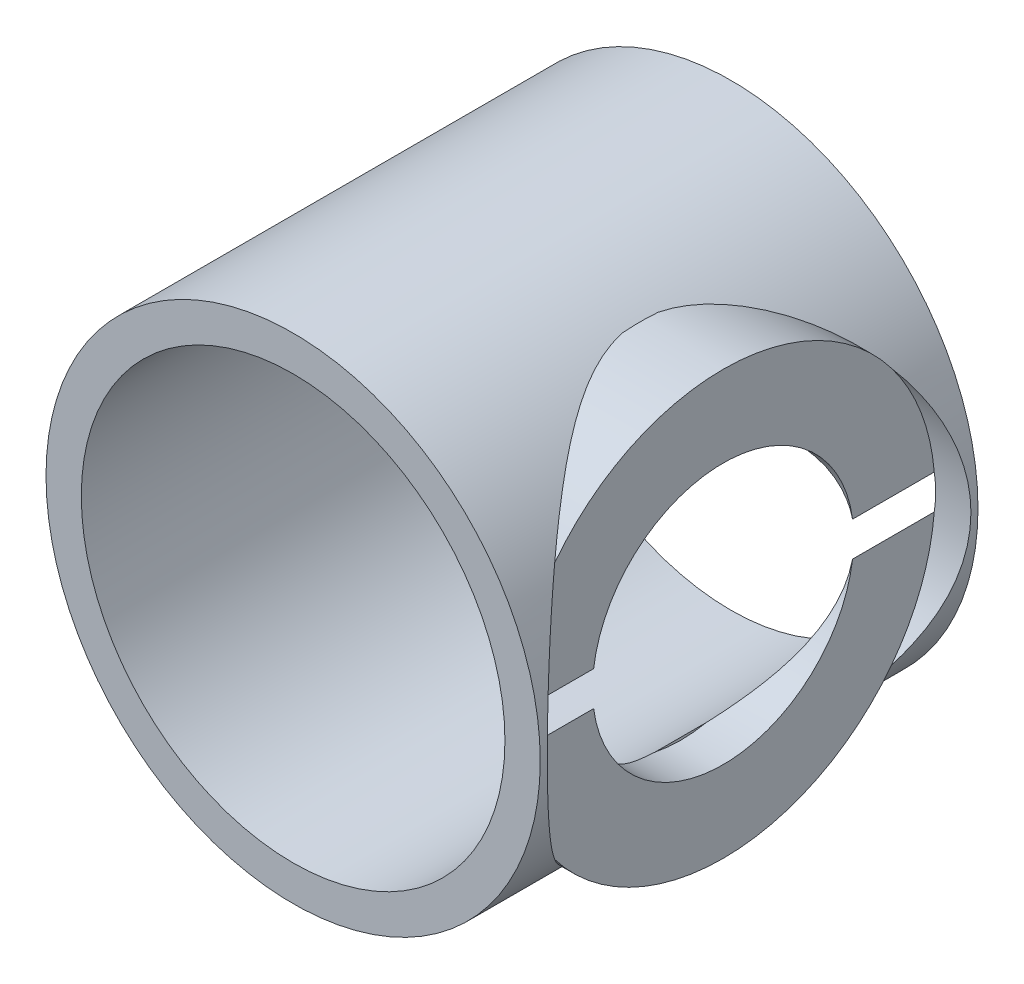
SolidWorks part; units mm, degrees
ref_plane "Front Plane" through (0, 0, 0) normal (0, 0, 1) x (1, 0, 0)
ref_plane "Top Plane" through (0, 0, 0) normal (0, 1, 0) x (1, 0, 0)
ref_plane "Right Plane" through (0, 0, 0) normal (1, 0, 0) x (0, 0, -1)
sketch "Sketch1" plane through (0, 0, 0) normal (0, 0, 1) x (1, 0, 0)
  circle A0 centre (0, 0) radius 44.45
  circle A1 centre (0, 0) radius 38.1
  dimension "D1" = 88.9
  dimension "D2" = 76.2
extrude "Boss-Extrude1" add sketch "Sketch1" along normal blind 78.74
ref_plane "Plane1" through (44.45, 0, 0) normal (1, 0, 0) x (0, 0, -1)
sketch "Sketch2" plane through (44.45, 0, 0) normal (1, 0, 0) x (0, 0, -1)
  line L0 (-78.74, 44.45) -> (-78.74, -44.45) construction
  circle A0 centre (-39.37, 0) radius 38.1
  dimension "D1" = 76.2
  dimension "D2" = 39.37
extrude "Boss-Extrude2" add sketch "Sketch2" against normal blind 21.336
sketch "Sketch3" plane through (0, 0, 78.74) normal (0, 0, 1) x (1, 0, 0)
  circle A0 centre (0, 0) radius 38.1
extrude "Cut-Extrude1" cut sketch "Sketch3" against normal blind 134.366
sketch "Sketch8" plane through (44.45, 0, 0) normal (1, 0, 0) x (0, 0, -1)
  circle A0 centre (-39.37, 0) radius 38.1
sketch "Sketch9" plane through (44.45, 0, 0) normal (1, 0, 0) x (0, 0, -1)
  circle A0 centre (-39.37, 0) radius 38.1
  dimension "D1" = 76.2
extrude "Cut-Extrude9" cut sketch "Sketch9" against normal blind 6.477
sketch "Sketch10" plane through (37.973, 0, 0) normal (1, 0, 0) x (0, 0, -1)
  circle A0 centre (-39.37, 0) radius 23.495
  dimension "D1" = 46.99
extrude "Cut-Extrude10" cut sketch "Sketch10" against normal blind 7.62
